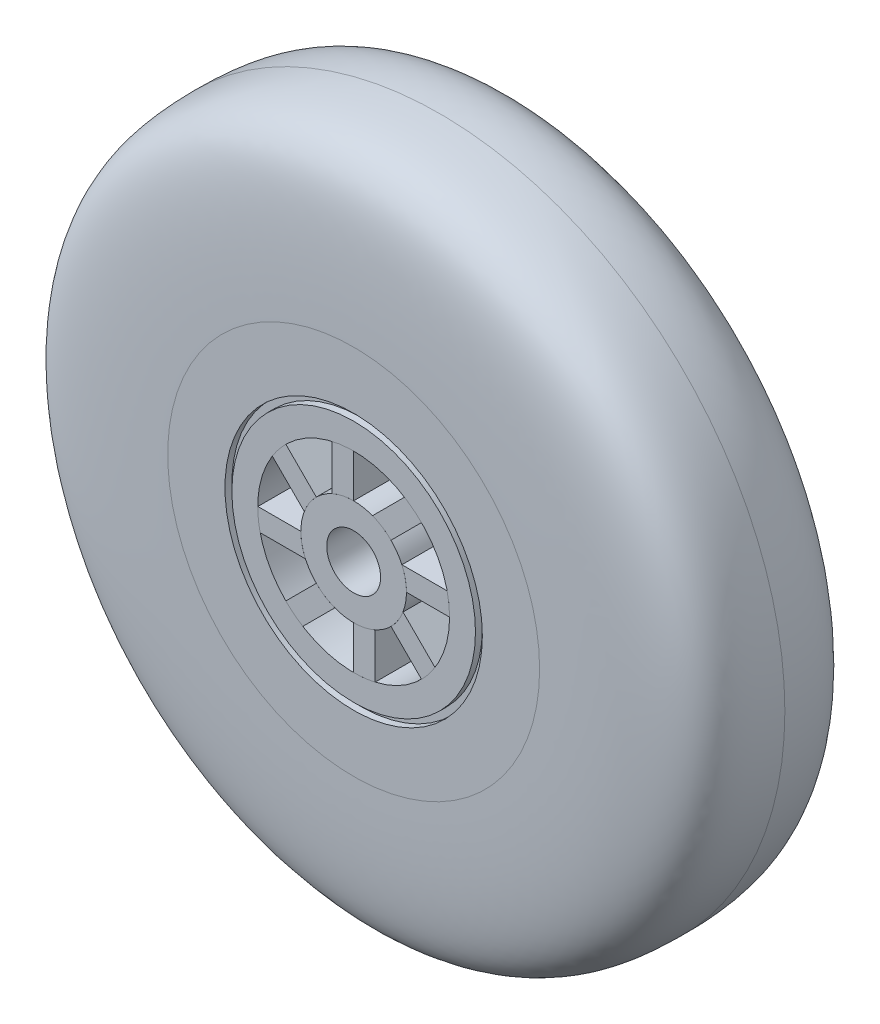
SolidWorks part; units mm, degrees
ref_plane "Front" through (0, 0, 0) normal (0, 0, 1) x (1, 0, 0)
ref_plane "Top" through (0, 0, 0) normal (0, 1, 0) x (1, 0, 0)
ref_plane "Right" through (0, 0, 0) normal (1, 0, 0) x (0, 0, -1)
sketch "Layout" plane through (0, 0, 0) normal (1, 0, 0) x (0, 0, -1)
  line L0 (0, 50.8) -> (0, -50.8) construction
  line L1 (-12.7, 0) -> (12.7, 0) construction
  line L2 (-12.7, 50.8) -> (12.7, 50.8) construction
  line L3 (0, 3.9688) -> (-12.7, 3.9688) construction
  dimension "Diameter" = 101.6
  dimension "For Axle" = 7.9375
  dimension "Hub Length" = 25.4
  dimension "Width" = 25.4
sketch "Sketch2" plane through (0, 0, 0) normal (1, 0, 0) x (0, 0, -1)
  line L0 (-12.7, 3.9688) -> (-12.7, 50.8) construction
  line L1 (-12.7, 50.8) -> (0, 50.8) construction
  line L3 (-12.7, 27.3844) -> (-12.7, 18.9547)
  line L4 (-12.7, 18.9547) -> (-11.684, 18.9547)
  line L5 (-11.684, 18.9547) -> (-11.684, 17.9387)
  line L6 (-11.684, 17.9387) -> (-12.7, 17.9387)
  line L7 (-12.7, 17.9387) -> (-12.7, 14.1287)
  line L8 (-12.7, 14.1287) -> (0, 14.1287)
  line L9 (0, 50.8) -> (0, -50.8) construction
  line L10 (-12.7, 3.9688) -> (-12.7, 7.7787)
  line L11 (-12.7, 7.7787) -> (0, 7.7787)
  line L12 (0, 7.7787) -> (0, 3.9688)
  line L13 (0, 3.9688) -> (-12.7, 3.9688)
  line L14 (0, 50.8) -> (0, 14.1287)
  line L15 (-12.7, 0) -> (12.7, 0) construction
  line L16 (-12.7, 0) -> (12.7, 0) construction
  conic Q0
  dimension "D1" = 3.81
  dimension "D2" = 1.016
  dimension "D3" = 6.35
  dimension "D4" = 3.81
revolve "Revolve1" add sketch "Sketch2" angle 360 about L16
sketch "Sketch3" plane through (0, 0, 12.7) normal (0, 0, 1) x (1, 0, 0)
  line L0 (0, 0) -> (9.9905, 9.9905) construction
  line L1 (2.7763, 7.2664) -> (7.4899, 11.9801)
  line L2 (-2.2451, 2.2451) -> (7.4899, 11.9801) construction
  line L3 (0, 0) -> (9.735, 9.735) construction
  line L4 (5.5004, 5.5004) -> (9.9905, 9.9905)
  line L5 (0, 50.8) -> (0, -50.8) construction
  line L6 (7.1013, 3.175) -> (13.7674, 3.175)
  line L7 (7.7787, 0) -> (14.1287, 0)
  line L8 (7.2664, -2.7763) -> (11.9801, -7.4899)
  line L9 (5.5004, -5.5004) -> (9.9905, -9.9905)
  line L10 (3.175, -7.1013) -> (3.175, -13.7674)
  line L11 (0, -7.7787) -> (0, -14.1287)
  line L12 (-2.7763, -7.2664) -> (-7.4899, -11.9801)
  line L13 (-5.5004, -5.5004) -> (-9.9905, -9.9905)
  line L14 (-7.1013, -3.175) -> (-13.7674, -3.175)
  line L15 (-7.7787, 0) -> (-14.1287, 0)
  line L16 (-7.2664, 2.7763) -> (-11.9801, 7.4899)
  line L17 (-5.5004, 5.5004) -> (-9.9905, 9.9905)
  line L18 (-3.175, 7.1013) -> (-3.175, 13.7674)
  line L19 (0, 7.7787) -> (0, 14.1287)
  circle A0 centre (0, 0) radius 14.1287 construction
  circle A1 centre (0, 0) radius 7.7787 construction
  arc A2 (9.9905, 9.9905) -> (7.4899, 11.9801) centre (0, 0) ccw
  arc A3 (5.5004, 5.5004) -> (2.7763, 7.2664) centre (0, 0) ccw
  arc A4 (14.1287, 0) -> (13.7674, 3.175) centre (0, 0) ccw
  arc A5 (7.7787, 0) -> (7.1013, 3.175) centre (0, 0) ccw
  arc A6 (9.9905, -9.9905) -> (11.9801, -7.4899) centre (0, 0) ccw
  arc A7 (5.5004, -5.5004) -> (7.2664, -2.7763) centre (0, 0) ccw
  arc A8 (0, -14.1287) -> (3.175, -13.7674) centre (0, 0) ccw
  arc A9 (0, -7.7787) -> (3.175, -7.1013) centre (0, 0) ccw
  arc A10 (-9.9905, -9.9905) -> (-7.4899, -11.9801) centre (0, 0) ccw
  arc A11 (-5.5004, -5.5004) -> (-2.7763, -7.2664) centre (0, 0) ccw
  arc A12 (-14.1287, 0) -> (-13.7674, -3.175) centre (0, 0) ccw
  arc A13 (-7.7787, 0) -> (-7.1013, -3.175) centre (0, 0) ccw
  arc A14 (-9.9905, 9.9905) -> (-11.9801, 7.4899) centre (0, 0) ccw
  arc A15 (-5.5004, 5.5004) -> (-7.2664, 2.7763) centre (0, 0) ccw
  arc A16 (0, 14.1287) -> (-3.175, 13.7674) centre (0, 0) ccw
  arc A17 (0, 7.7787) -> (-3.175, 7.1013) centre (0, 0) ccw
  point P42 (0, 0)
  dimension "D2" = 45
  dimension "D1" = 3.175
  dimension "D3" = 8
extrude "Boss-Extrude1" add sketch "Sketch3" against normal up to vertex (12.7 mm away) separate body
mirror "Mirror1" about plane through (0, 0, 0) normal (0, 0, 1)
ref_plane "Plane1" through (0, -50.8, 0) normal (0, 1, 0) x (1, 0, 0)
ref_plane "Plane2" through (50.8, 0, 0) normal (1, 0, 0) x (0, 0, -1)
